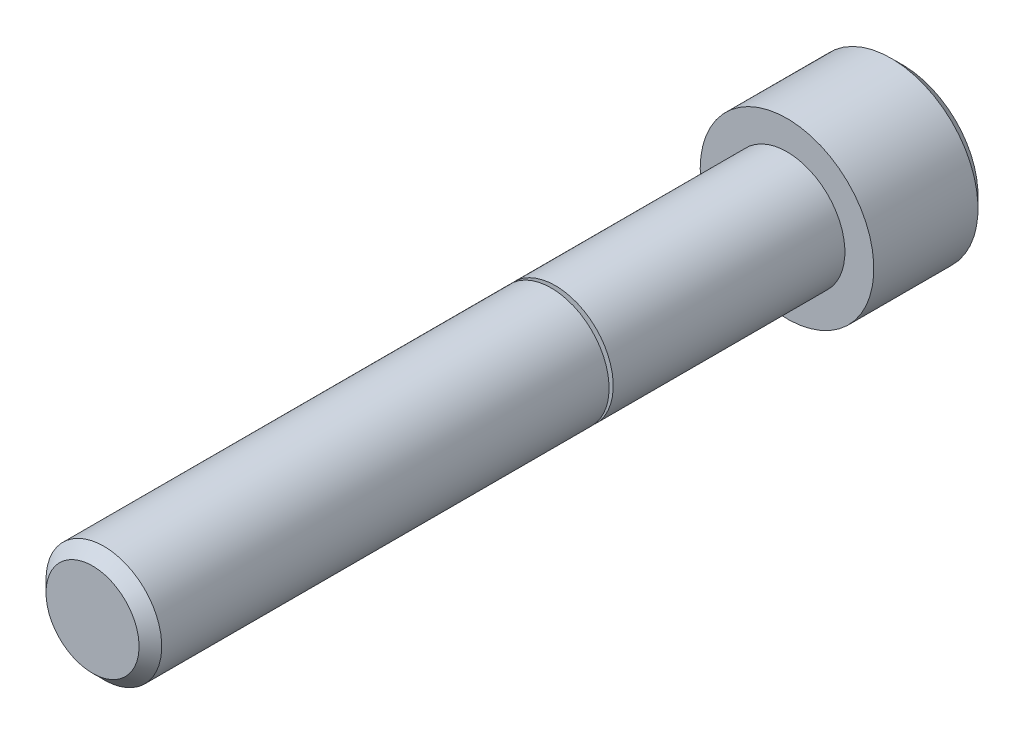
SolidWorks part; units mm, degrees
ref_plane "Front" through (0, 0, 0) normal (0, 0, 1) x (1, 0, 0)
ref_plane "Top" through (0, 0, 0) normal (0, 1, 0) x (1, 0, 0)
ref_plane "Right" through (0, 0, 0) normal (1, 0, 0) x (0, 0, -1)
sketch "Logo3_Revol_Axis" plane through (0, 0, 0) normal (0, 1, 0) x (1, 0, 0)
  line L0 (0, -43.5172) -> (0, 43.5172) construction
sketch "Logo3_bib1" plane through (0, 0, 0) normal (0, -1, 0) x (-1, 0, 0)
  line L0 (0, -38.1) -> (0, 6.35)
  line L1 (0, 6.35) -> (4.1275, 6.35)
  line L2 (4.7625, 5.715) -> (4.7625, 0)
  line L3 (4.7625, 0) -> (3.175, 0)
  line L4 (3.175, 0) -> (3.175, -12.71)
  line L5 (3.175, -37.4777) -> (2.5527, -38.1)
  line L6 (2.5527, -38.1) -> (0, -38.1)
  line L7 (3.175, -12.71) -> (2.6661, -12.71)
  line L8 (2.6593, -12.7488) -> (3.175, -12.9365)
  line L9 (3.175, -12.9365) -> (3.175, -37.4777)
  line L10 (0, 10.5852) -> (0, -63.2873) construction
  line L11 (4.1275, 6.35) -> (4.7625, 5.715)
  arc A1 (2.6661, -12.71) -> (2.6593, -12.7488) centre (2.6661, -12.73) ccw
  point P17 (2.5527, -12.71)
  point P19 (4.7625, 6.35)
revolve "Revolve1" add sketch "Logo3_bib1" angle 360 about L10
sketch "Logo3_bib2" plane through (0, 0, -6.35) normal (0, 0, -1) x (1, 0, 0)
  line L1 (2.7496, 0) -> (1.3748, 2.3813)
  line L2 (1.3748, 2.3813) -> (-1.3748, 2.3813)
  line L3 (-1.3748, 2.3813) -> (-2.7496, 0)
  line L4 (-2.7496, 0) -> (-1.3748, -2.3813)
  line L5 (-1.3748, -2.3813) -> (1.3748, -2.3813)
  line L6 (1.3748, -2.3813) -> (2.7496, 0)
  circle A0 centre (0, 0) radius 2.3812 construction
  dimension "Logo3_c1" = 4.7625
extrude "Cut-Extrude1" cut sketch "Logo3_bib2" against normal blind 3.175
equation "\"DIA2@Logo3_bib1\" = \"Logo3_d1-pas@Logo3_bib1\""
equation "\"LGT1@Logo3_bib1\" = \"Logo3_d1@Logo3_bib1\""
equation "\"D1@Cut-Extrude1\" = \"Logo3_d1@Logo3_bib1\"/2."
equation "\"D2@Cosmetic Thread1\" = \"Logo3_d1-pas@Logo3_bib1\""
equation "\"D5@Logo3_bib1\"=\"Logo3_d1@Logo3_bib1\"*.1"
